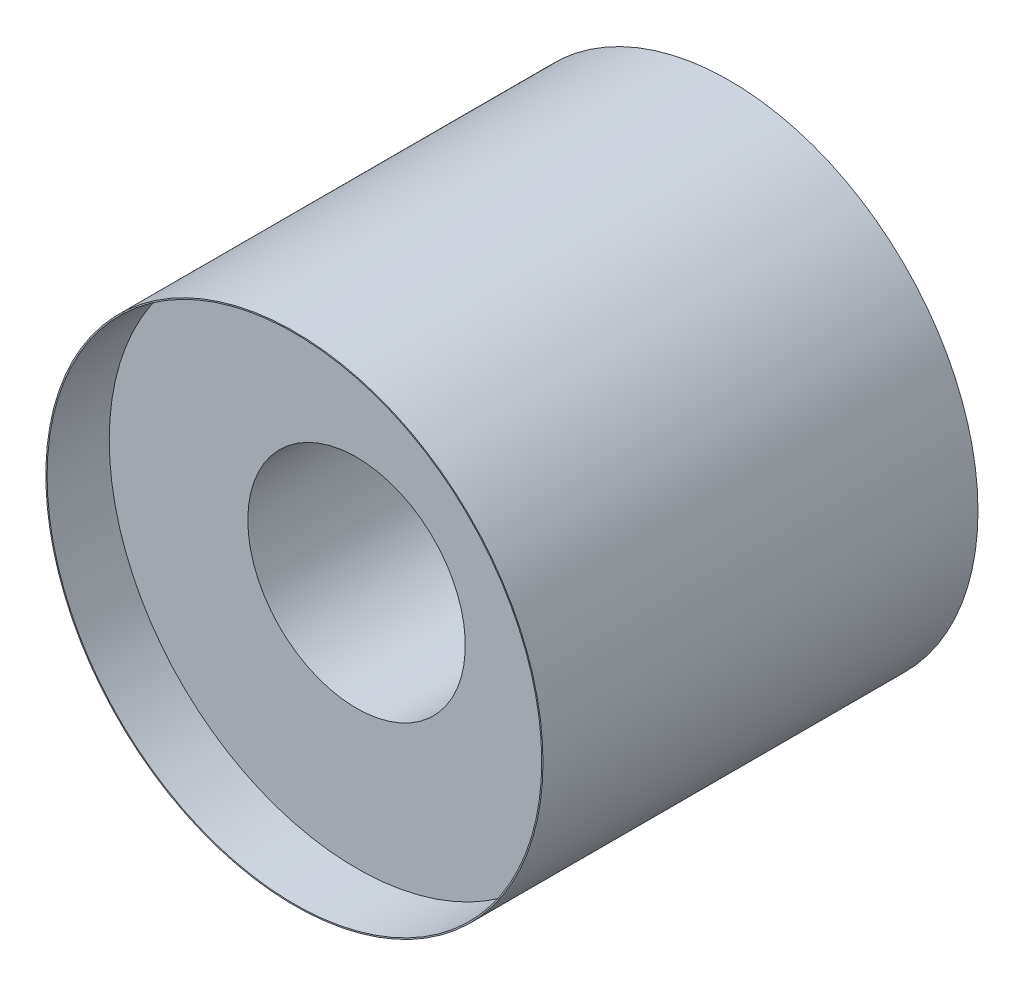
SolidWorks part; units mm, degrees
ref_plane "Front Plane" through (0, 0, 0) normal (0, 0, 1) x (1, 0, 0)
ref_plane "Top Plane" through (0, 0, 0) normal (0, 1, 0) x (1, 0, 0)
ref_plane "Right Plane" through (0, 0, 0) normal (1, 0, 0) x (0, 0, -1)
sketch "Sketch1" plane through (0, 0, 0) normal (0, 0, 1) x (1, 0, 0)
  circle A0 centre (0, 0) radius 25.4
  dimension "D1" = 50.8
extrude "Boss-Extrude1" add sketch "Sketch1" along normal blind 44.45
sketch "Sketch2" plane through (0, 0, 44.45) normal (0, 0, 1) x (1, 0, 0)
  circle A0 centre (0, 0) radius 25.273
  dimension "D1" = 50.546
extrude "Cut-Extrude1" cut sketch "Sketch2" against normal blind 6.35 contours A0
sketch "Sketch3" plane through (0, 0, 0) normal (0, 0, -1) x (-1, 0, 0)
  circle A0 centre (0, 0) radius 25.273
  dimension "D1" = 50.546
extrude "Cut-Extrude2" cut sketch "Sketch3" against normal blind 6.35 contours A0
sketch "Sketch4" plane through (0, 0, 6.35) normal (0, 0, -1) x (-1, 0, 0)
  circle A0 centre (0, 0) radius 11.1125
  dimension "D1" = 22.225
extrude "Cut-Extrude3" cut sketch "Sketch4" against normal blind 31.75 contours A0
